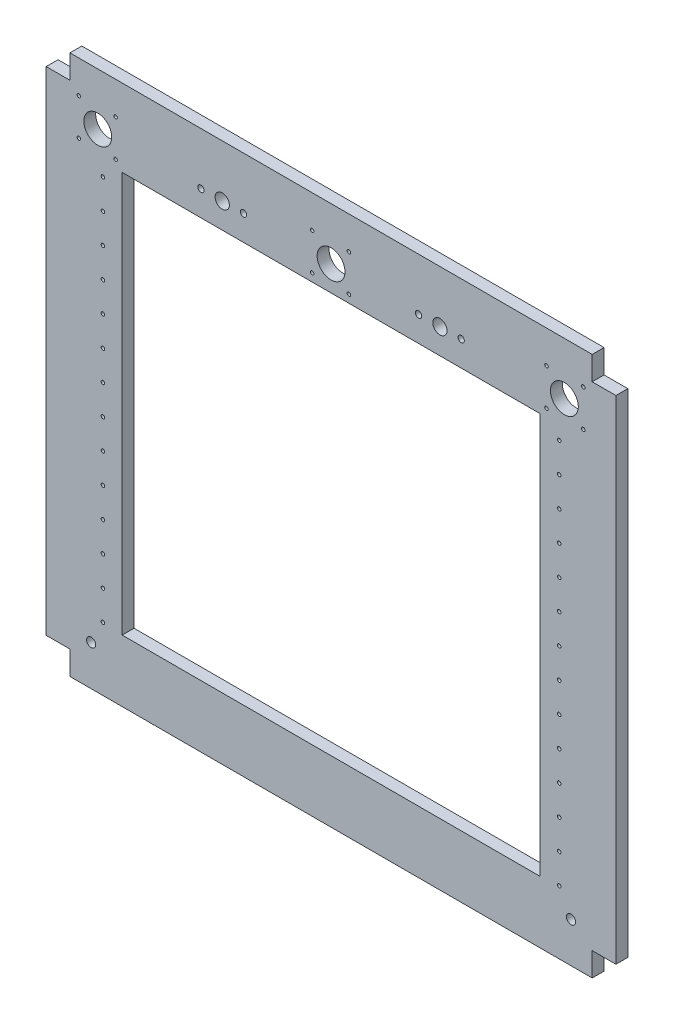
SolidWorks part; units mm, degrees
ref_plane "Front Plane" through (0, 0, 0) normal (0, 0, 1) x (1, 0, 0)
ref_plane "Top Plane" through (0, 0, 0) normal (0, 1, 0) x (1, 0, 0)
ref_plane "Right Plane" through (0, 0, 0) normal (1, 0, 0) x (0, 0, -1)
sketch "Sketch2" plane through (0, 0, 0) normal (0, 0, 1) x (1, 0, 0)
  line L0 (-176, 162.3) -> (176, 162.3)
  line L5 (-176, -175.3) -> (176, -175.3)
  line L6 (-220, 227.5) -> (-220, 207.5)
  line L7 (0, 227.5) -> (0, -227.5) construction
  line L8 (176, 162.3) -> (176, -175.3)
  line L9 (240, 207.5) -> (240, -207.5)
  line L10 (220, -227.5) -> (-220, -227.5)
  line L11 (-240, -207.5) -> (-240, 207.5)
  line L12 (-176, 162.3) -> (-176, -175.3)
  line L13 (-220, 207.5) -> (-240, 207.5)
  line L14 (-220, 227.5) -> (220, 227.5)
  line L19 (220, 227.5) -> (220, 207.5)
  line L20 (220, 207.5) -> (240, 207.5)
  line L21 (-303.0105, 0) -> (317.9445, 0) construction
  line L22 (220, -207.5) -> (240, -207.5)
  line L23 (220, -227.5) -> (220, -207.5)
  line L24 (-220, -207.5) -> (-240, -207.5)
  line L25 (-220, -227.5) -> (-220, -207.5)
  point P0 (0, 0)
  point P14 (220, -207.5)
  point P17 (220, 207.5)
  point P20 (-220, 207.5)
  dimension "D1" = 440
  dimension "D2" = 415
  dimension "D3" = 20
  dimension "D4" = 20
  dimension "D7" = 352
extrude "Boss-Extrude1" add sketch "Sketch2" along normal blind 10
sketch "Sketch3" plane through (0, 0, 10) normal (0, 0, 1) x (1, 0, 0)
  line L0 (0, 234.8813) -> (0, -234.8723) construction
  line L1 (-355.1188, 0) -> (411.1902, 0) construction
extrude "Cut-Extrude4" cut sketch "Sketch4" against normal blind 10
sketch "Sketch4" plane through (0, 0, 10) normal (0, 0, 1) x (1, 0, 0)
  line L0 (210, 207.5) -> (-210, 207.5) construction
  line L1 (-220, 197.5) -> (-220, -197.5) construction
  line L2 (0, 234.8813) -> (0, -360.1846) construction
  line L3 (-23.45, 229.4772) -> (-23.45, 132.7347) construction
  line L4 (-196.55, 183.55) -> (196.55, 183.55) construction
  line L5 (-91.7, 229.4772) -> (-91.7, 149.0673) construction
  line L6 (-210, -207.5) -> (210, -207.5) construction
  line L7 (196.55, 250.8422) -> (196.55, -224.468) construction
  line L8 (-355.1188, 0) -> (411.1902, 0) construction
  circle A0 centre (-196.55, 183.55) radius 11.75
  circle A1 centre (-181.5, 200) radius 1.5
  circle A2 centre (-181.5, 169) radius 1.5
  circle A3 centre (-212.5, 200) radius 1.5
  circle A4 centre (-212.5, 169) radius 1.5
  circle A5 centre (196.55, 183.55) radius 11.75
  circle A6 centre (212.5, 169) radius 1.5
  circle A7 centre (181.5, 169) radius 1.5
  circle A8 centre (181.5, 200) radius 1.5
  circle A9 centre (212.5, 200) radius 1.5
  circle A10 centre (0, 183.55) radius 11.75
  circle A11 centre (-15.95, 200) radius 1.5
  circle A12 centre (15.05, 200) radius 1.5
  circle A13 centre (15.05, 169) radius 1.5
  circle A14 centre (-15.95, 169) radius 1.5
  circle A15 centre (-109.65, 183.55) radius 2.65
  circle A16 centre (-91.7, 183.55) radius 6
  circle A17 centre (-73.75, 183.55) radius 2.65
  circle A18 centre (73.75, 183.55) radius 2.65
  circle A19 centre (109.65, 183.55) radius 2.65
  circle A20 centre (91.7, 183.55) radius 6
  circle A36 centre (-192.2028, 150.8866) radius 1.5
  circle A37 centre (-192.2028, 125.8866) radius 1.5
  circle A38 centre (-192.2028, 100.8866) radius 1.5
  circle A39 centre (-192.2028, 75.8866) radius 1.5
  circle A40 centre (-192.2028, 50.8866) radius 1.5
  circle A41 centre (-192.2028, 25.8866) radius 1.5
  circle A42 centre (-192.2028, 0.8866) radius 1.5
  circle A43 centre (-192.2028, -24.1134) radius 1.5
  circle A44 centre (-192.2028, -49.1134) radius 1.5
  circle A45 centre (-192.2028, -74.1134) radius 1.5
  circle A46 centre (-192.2028, -99.1134) radius 1.5
  circle A47 centre (-192.2028, -124.1134) radius 1.5
  circle A48 centre (-192.2028, -149.1134) radius 1.5
  circle A49 centre (-192.2028, -174.1134) radius 1.5
  circle A50 centre (-202.15, -193.65) radius 3.85
  circle A51 centre (202.15, -193.65) radius 3.85
  circle A52 centre (192.2028, -174.1134) radius 1.5
  circle A53 centre (192.2028, -149.1134) radius 1.5
  circle A54 centre (192.2028, -124.1134) radius 1.5
  circle A55 centre (192.2028, -99.1134) radius 1.5
  circle A56 centre (192.2028, -74.1134) radius 1.5
  circle A57 centre (192.2028, -49.1134) radius 1.5
  circle A58 centre (192.2028, -24.1134) radius 1.5
  circle A59 centre (192.2028, 0.8866) radius 1.5
  circle A60 centre (192.2028, 25.8866) radius 1.5
  circle A61 centre (192.2028, 50.8866) radius 1.5
  circle A62 centre (192.2028, 75.8866) radius 1.5
  circle A63 centre (192.2028, 100.8866) radius 1.5
  circle A64 centre (192.2028, 125.8866) radius 1.5
  circle A65 centre (192.2028, 150.8866) radius 1.5
  point P58 (-192.2028, 0)
  dimension "D1" = 23.5
  dimension "D4" = 3
  dimension "D5" = 3
  dimension "D6" = 3
  dimension "D7" = 3
  dimension "D16" = 31
  dimension "D18" = 23.5
  dimension "D19" = 3
  dimension "D20" = 3
  dimension "D21" = 3
  dimension "D22" = 3
  dimension "D33" = 5.3
  dimension "D35" = 12
  dimension "D38" = 7.7
  dimension "D40" = 17.85
  dimension "D37" = 3
  dimension "D66" = 3
  dimension "D67" = 3
  dimension "D68" = 3
  dimension "D69" = 3
  dimension "D70" = 3
  dimension "D71" = 3
  dimension "D72" = 3
  dimension "D73" = 3
  dimension "D74" = 3
  dimension "D75" = 3
  dimension "D76" = 3
  dimension "D77" = 3
  dimension "D78" = 3
  dimension "D79" = 3
  dimension "D2" = 23.95
  dimension "D3" = 23.45
  dimension "D8" = 31
  dimension "D9" = 31
  dimension "D10" = 31
  dimension "D11" = 31
  dimension "D12" = 7.5
  dimension "D13" = 7.5
  dimension "D14" = 7.5
  dimension "D15" = 7.5
  dimension "D17" = 15.95
  dimension "D23" = 31
  dimension "D24" = 31
  dimension "D25" = 31
  dimension "D26" = 31
  dimension "D27" = 7.5
  dimension "D28" = 23.45
  dimension "D29" = 23.45
  dimension "D30" = 7.5
  dimension "D31" = 7.5
  dimension "D32" = 23.45
  dimension "D34" = 86.9
  dimension "D36" = 17.95
  dimension "D39" = 25
  dimension "D45" = 25
  dimension "D46" = 25
  dimension "D47" = 25
  dimension "D49" = 25
  dimension "D52" = 25
  dimension "D53" = 25
  dimension "D57" = 25
  dimension "D58" = 25
  dimension "D59" = 25
  dimension "D62" = 25
  dimension "D63" = 25
  dimension "D65" = 25
  dimension "13.85" = 13.85
extrude "Cut-Extrude3" cut sketch "Sketch4" against normal blind 10
